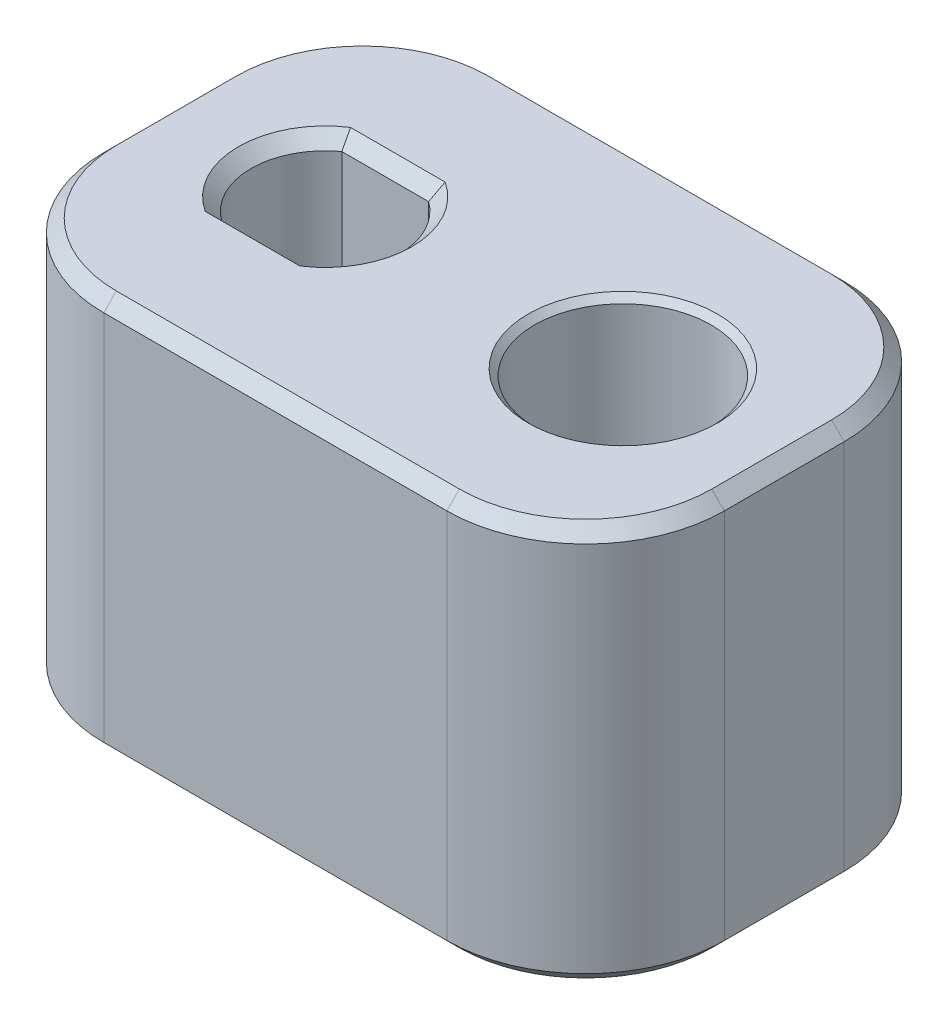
SolidWorks part; units mm, degrees
ref_plane "Front Plane" through (0, 0, 0) normal (0, 0, 1) x (1, 0, 0)
ref_plane "Top Plane" through (0, 0, 0) normal (0, 1, 0) x (1, 0, 0)
ref_plane "Right Plane" through (0, 0, 0) normal (1, 0, 0) x (0, 0, -1)
sketch "Sketch1" plane through (0, 0, 0) normal (0, 1, 0) x (1, 0, 0)
  line L1 (-12.4968, -8.001) -> (12.4968, -8.001)
  line L2 (-12.4968, -8.001) -> (-12.4968, 8.001)
  line L3 (-12.4968, 8.001) -> (12.4968, 8.001)
  line L4 (12.4968, -8.001) -> (12.4968, 8.001)
  line L5 (-12.4968, -8.001) -> (12.4968, 8.001) construction
  line L6 (-12.4968, 8.001) -> (12.4968, -8.001) construction
  point P0 (0, 0)
  dimension "D1" = 24.9936
  dimension "D2" = 16.002
extrude "Extrude1" add sketch "Sketch1" along normal blind 16.002
fillet "Fillet1" radius 5.588 4 edges at (-12.4968, 8.001, -8.001) (-12.4968, 8.001, 8.001) (12.4968, 8.001, -8.001) (12.4968, 8.001, 8.001)
sketch "Sketch4" plane through (0, 16.002, 0) normal (0, 1, 0) x (1, 0, 0)
  line L0 (-7.742, 2.4193) -> (-4.2468, 2.4193)
  line L1 (-0.2714, 0) -> (-16.7902, 0) construction
  line L2 (-7.742, -2.4194) -> (-4.2468, -2.4194)
  arc A0 (-4.2468, -2.4194) -> (-4.2468, 2.4193) centre (-5.9944, 0) ccw
  arc A1 (-7.742, 2.4193) -> (-7.742, -2.4194) centre (-5.9944, 0) ccw
  dimension "D2" = 5.969
  dimension "D3" = 5.9944
  dimension "D1" = 4.8387
extrude "Extrude2" cut sketch "Sketch4" against normal through all
chamfer "Chamfer2" distance 0.508 angle 45 8 edges at (-3.0099, 16.002, 0) (-5.9944, 16.002, 2.4194) (-8.9789, 16.002, 0) (-5.9944, 16.002, -2.4193) (-5.9944, 0, 2.4194) (-3.0099, 0, 0) (-8.9789, 0, 0) (-5.9944, 0, -2.4193)
sketch "Sketch3" plane through (0, 0, 0) normal (0, 0, 1) x (1, 0, 0)
  line L0 (5.9944, -4.1204) -> (5.9944, 20.8145) construction
  line L1 (5.9944, 16.002) -> (2.1844, 16.002)
  line L2 (-6.9088, 16.002) -> (6.9088, 16.002) construction
  line L3 (2.4384, 7.112) -> (0.8382, 7.112)
  line L4 (0.8382, 7.112) -> (0.8382, 0.508)
  line L5 (2.4384, 15.748) -> (2.4384, 7.112)
  line L6 (-6.9088, 0) -> (6.9088, 0) construction
  line L7 (0.3302, 0) -> (5.9944, 0)
  line L8 (5.9944, 0) -> (5.9944, 16.002)
  line L9 (2.4384, 15.748) -> (2.1844, 16.002)
  line L10 (0.8382, 0.508) -> (0.3302, 0)
  dimension "D1" = 5.9944
  dimension "D2" = 7.112
  dimension "D3" = 10.3124
  dimension "D4" = 0.508
  dimension "D5" = 45
  dimension "D6" = 0.254
  dimension "D7" = 45
  dimension "D8" = 7.112
revolve "Cut-Revolve2" cut sketch "Sketch3" angle 360 about L0
chamfer "Chamfer1" distance 0.508 angle 45 16 edges at (0, 0, -8.001) (-10.8601, 0, -6.3643) (10.8601, 0, -6.3643) (-12.4968, 0, 0) (12.4968, 0, 0) (-10.8601, 0, 6.3643) (10.8601, 0, 6.3643) (0, 0, 8.001) (0, 16.002, -8.001) (-10.8601, 16.002, -6.3643) (10.8601, 16.002, -6.3643) (-12.4968, 16.002, 0) (12.4968, 16.002, 0) (-10.8601, 16.002, 6.3643) (10.8601, 16.002, 6.3643) (0, 16.002, 8.001)
